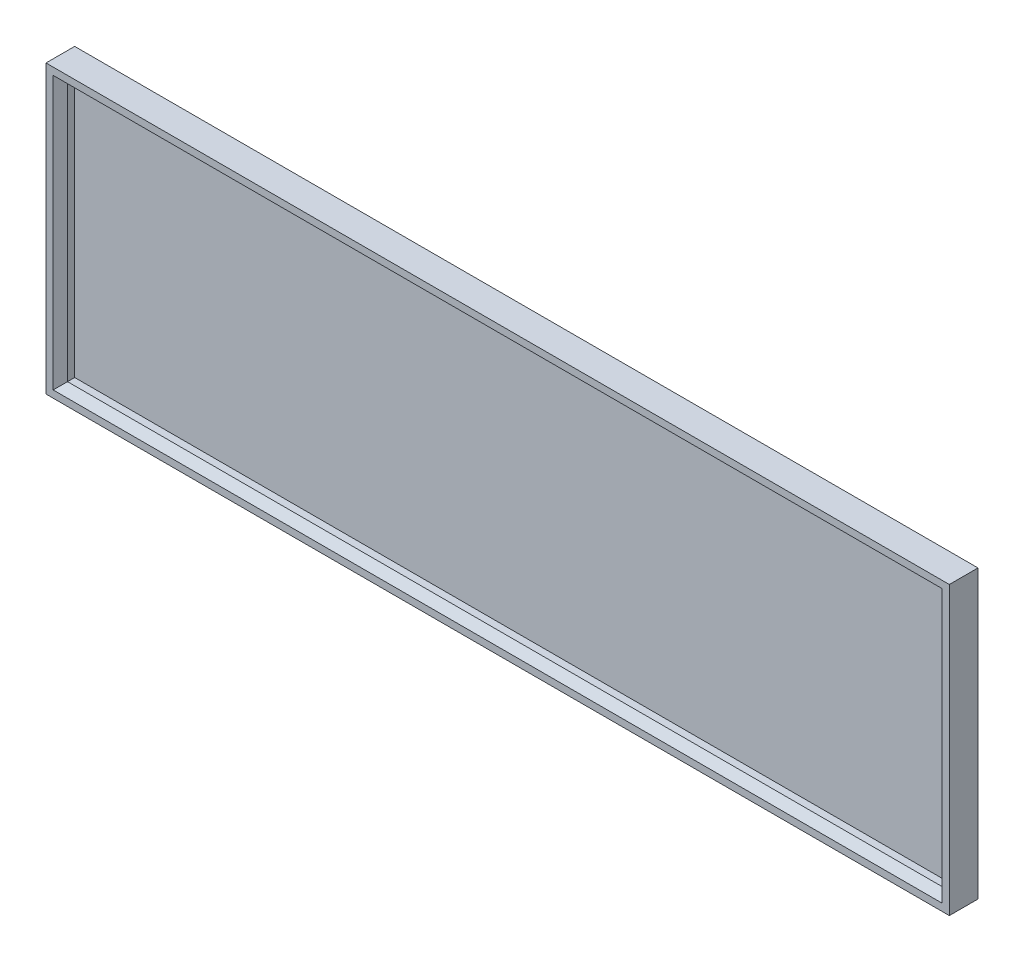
SolidWorks part; units mm, degrees
ref_plane "前基準面" through (0, 0, 0) normal (0, 0, 1) x (1, 0, 0)
ref_plane "上基準面" through (0, 0, 0) normal (0, 1, 0) x (1, 0, 0)
ref_plane "右基準面" through (0, 0, 0) normal (1, 0, 0) x (0, 0, -1)
sketch "草圖1" plane through (0, 0, 0) normal (0, 0, 1) x (1, 0, 0)
  line L1 (0, 0) -> (630, 0)
  line L2 (0, 0) -> (0, -200)
  line L3 (0, -200) -> (630, -200)
  line L4 (630, 0) -> (630, -200)
  dimension "D1" = 630
  dimension "D2" = 200
extrude "填料-伸長1" add sketch "草圖1" along normal blind 20
shell "薄殼2" thickness 10
shell "薄殼4" thickness 10
chamfer "導角1" distance 5 angle 45 4 edges at (315, -190, 20) (620, -100, 20) (10, -100, 20) (315, -10, 20)
